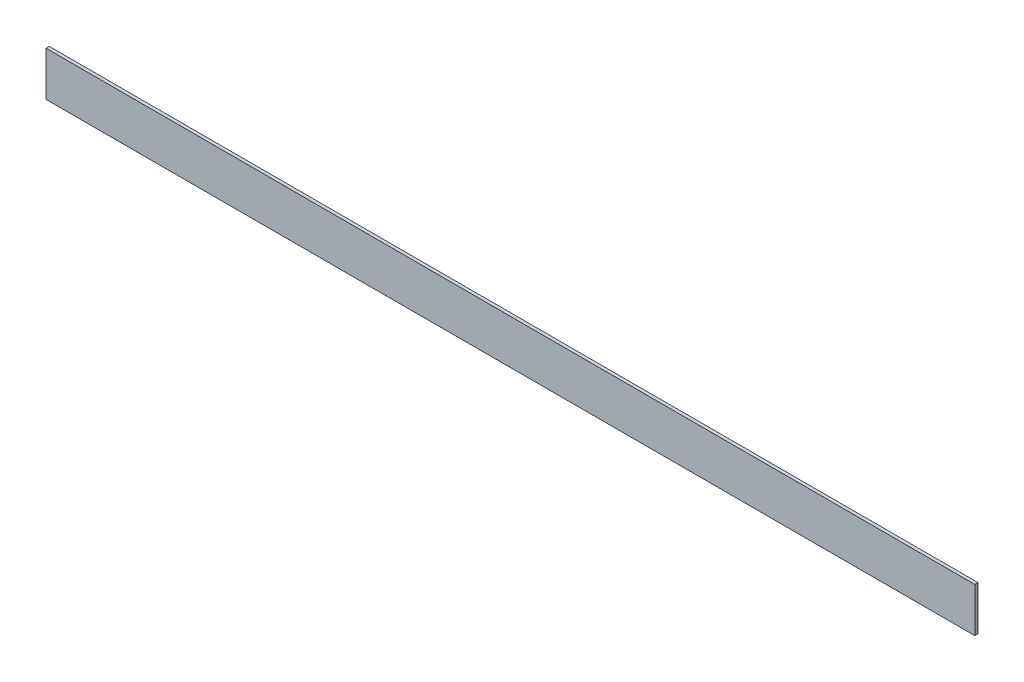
SolidWorks part; units mm, degrees
ref_plane "Front Plane" through (0, 0, 0) normal (0, 0, 1) x (1, 0, 0)
ref_plane "Top Plane" through (0, 0, 0) normal (0, 1, 0) x (1, 0, 0)
ref_plane "Right Plane" through (0, 0, 0) normal (1, 0, 0) x (0, 0, -1)
sketch "Sketch1" plane through (0, 0, 0) normal (0, 0, 1) x (1, 0, 0)
  line L1 (-86.5216, 52.6454) -> (578.1964, 52.6454)
  line L2 (-86.5216, 52.6454) -> (-86.5216, 20.8954)
  line L3 (-86.5216, 20.8954) -> (578.1964, 20.8954)
  line L4 (578.1964, 52.6454) -> (578.1964, 20.8954)
  dimension "D1" = 31.75
  dimension "D2" = 664.718
base flange "Base-Flange1" sketch "Sketch1" thickness 2.286 reverse thickness direction no parameters "D1"=2.286
sketch "Bend-Lines1" [suppressed] plane through (0, 0, 0) normal (0, 1, 0) x (1, 0, 0)
sketch "Bounding-Box1" [suppressed] plane through (0, 0, 0) normal (0, 1, 0) x (1, 0, 0)
sheet metal parameters "Sheet-Metal1" thickness 2.286 parameters "D1"=2.286
flat pattern "Flat-Pattern1"
sketch "Bend-Lines2" plane through (0, 0, 0) normal (0, 1, 0) x (1, 0, 0)
sketch3d "Bounding-Box2" [suppressed]
  line L0 (-86.5216, 20.8954, 0) -> (578.1964, 20.8954, 0) construction
  line L1 (-86.5216, 52.6454, 0) -> (578.1964, 52.6454, 0) construction
  line L2 (-86.5216, 20.8954, 0) -> (-86.5216, 52.6454, 0) construction
  line L3 (578.1964, 20.8954, 0) -> (578.1964, 52.6454, 0) construction
